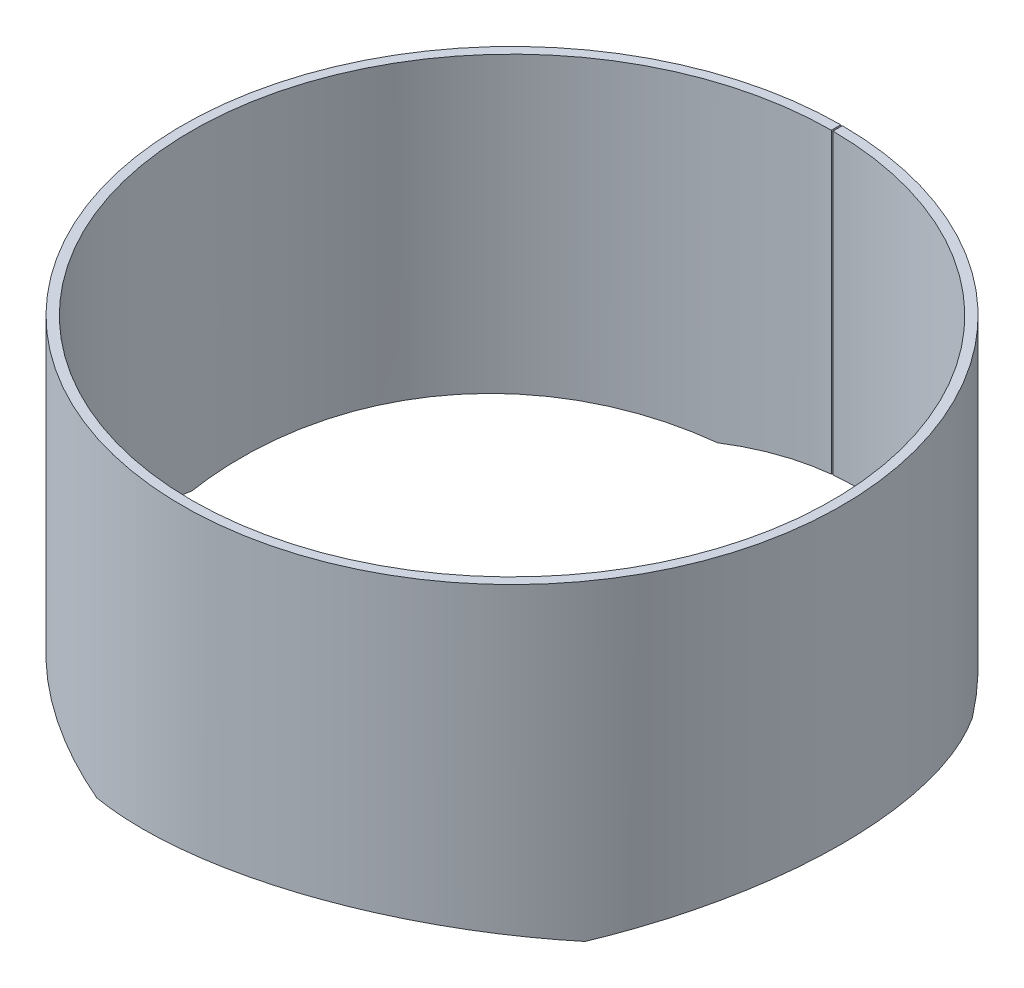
SolidWorks part; units mm, degrees
ref_plane "前视基准面" through (0, 0, 0) normal (0, 0, 1) x (1, 0, 0)
ref_plane "上视基准面" through (0, 0, 0) normal (0, 1, 0) x (1, 0, 0)
ref_plane "右视基准面" through (0, 0, 0) normal (1, 0, 0) x (0, 0, -1)
imported_body "基体零件-等径Y形五通管-1"
sheet metal parameters "钣金1" parameters "D1"=0.7366, "厚度"=6
bend "圆角折弯1" bend radius 204 bend angle 359.727 parameters "D5"=1
flatten bends "展开-折弯1" parameters "D1"=0
sketch "尖角-草图1" plane through (0.5, 155.1324, -209.9994) normal (0.0024, 0, -1) x (-1, 0, -0.0024)
  line L0 (-640.3992, -94.9142) -> (-640.3992, 94.8676) construction
process bends "加工-折弯1" parameters "D1"=0
sketch "平面-草图1" plane through (0.5, 155.1324, -209.9994) normal (0.0024, 0, -1) x (-1, 0, -0.0024)
